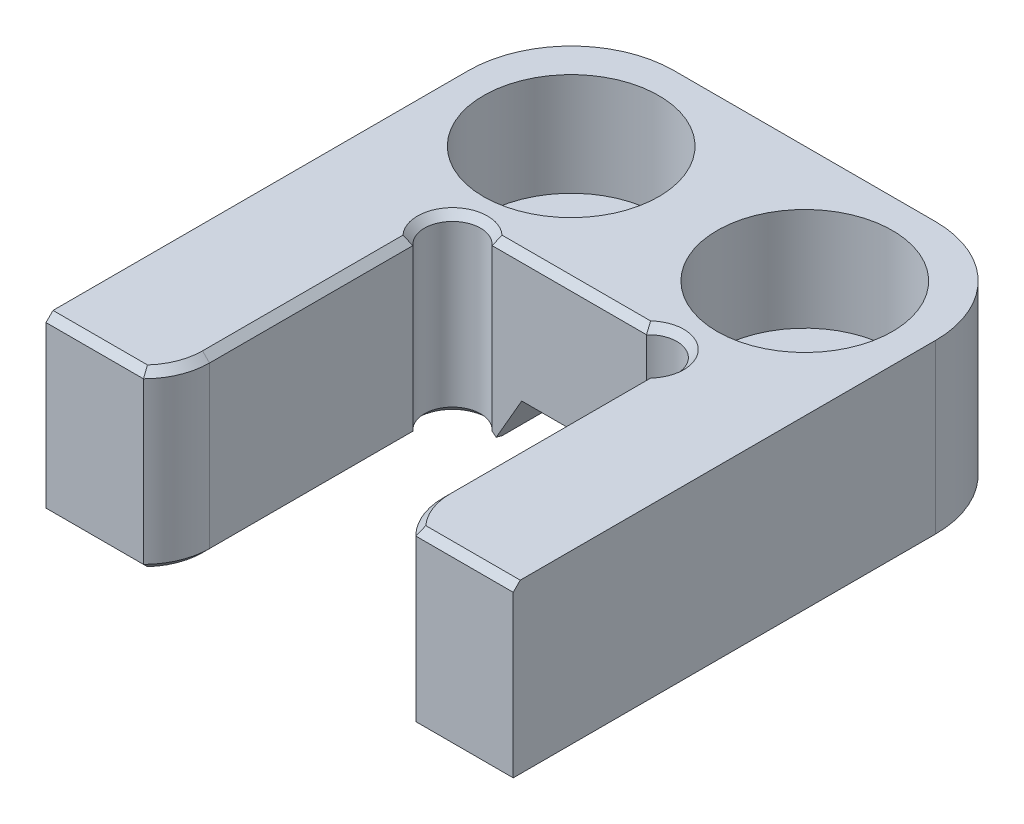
SolidWorks part; units mm, degrees
ref_plane "Front Plane" through (0, 0, 0) normal (0, 0, 1) x (1, 0, 0)
ref_plane "Top Plane" through (0, 0, 0) normal (0, 1, 0) x (1, 0, 0)
ref_plane "Right Plane" through (0, 0, 0) normal (1, 0, 0) x (0, 0, -1)
sketch "Sketch1" plane through (0, 0, 0) normal (0, 1, 0) x (1, 0, 0)
  line L0 (0, 0) -> (0, 50000) construction
  line L1 (0, 0) -> (50000, 0) construction
  line L2 (6.35, 0) -> (12.7, 0)
  line L3 (-12.7, 0) -> (-6.35, 0)
  line L4 (-12.7, 0) -> (-12.7, 28.5496)
  line L5 (-12.7, 28.5496) -> (12.7, 28.5496)
  line L6 (12.7, 0) -> (12.7, 28.5496)
  line L8 (-6.35, 0) -> (-6.35, 15.748)
  line L9 (-6.35, 15.748) -> (6.35, 15.748)
  line L10 (6.35, 0) -> (6.35, 15.748)
  dimension "D1" = 28.5496
  dimension "D2" = 25.4
  dimension "D3" = 12.7
  dimension "D4" = 15.748
extrude "Boss-Extrude1" add sketch "Sketch1" against normal blind 9.4996 separate body
fillet "Fillet1" radius 5.588 2 edges at (12.7, -4.7498, -28.5496) (-12.7, -4.7498, -28.5496)
sketch "Sketch2" plane through (0, 0, 0) normal (0, 1, 0) x (1, 0, 0)
  line L0 (0, 0) -> (0, 50000) construction
  line L1 (-6.35, 0) -> (-6.35, 15.748) construction
  line L2 (-12.7, 0) -> (-6.35, 0) construction
  line L3 (-6.35, 2.54) -> (-6.35, 12.7)
  line L4 (-12.7, 0) -> (-7.4024, 0)
  line L5 (12.7, 0) -> (12.7, -12.7)
  line L6 (-12.7, -12.7) -> (12.7, -12.7)
  line L7 (-6.35, 12.7) -> (6.35, 12.7)
  line L8 (-12.7, 0) -> (-12.7, -12.7)
  line L9 (12.7, 0) -> (7.4024, 0)
  line L10 (6.35, 2.54) -> (6.35, 12.7)
  arc A0 (-6.68, 0.5195) -> (-7.4024, 0) centre (-7.4024, 0.762) cw construction
  arc A1 (6.68, 0.5195) -> (6.35, 2.54) centre (12.7, 2.54) cw construction
  arc A2 (-6.68, 0.5195) -> (-6.35, 2.54) centre (-12.7, 2.54) ccw construction
  arc A3 (6.68, 0.5195) -> (7.4024, 0) centre (7.4024, 0.762) ccw construction
  arc A4 (7.4024, 0) -> (6.35, 2.54) centre (9.9414, 2.54) cw
  arc A5 (-7.4024, 0) -> (-6.35, 2.54) centre (-9.9414, 2.54) ccw
  point P14 (0, -12.7)
  point P24 (0, 12.7)
  dimension "D1" = 0.762
  dimension "D2" = 6.35
  dimension "D3" = 2.54
  dimension "D4" = 12.7
  dimension "D5" = 12.7
extrude "Cut-Extrude1" cut sketch "Sketch2" against normal through all
sketch "Sketch3" plane through (0, 0, 0) normal (0, 1, 0) x (1, 0, 0)
  line L2 (-6.858, 2.54) -> (-6.858, 15.748)
  line L3 (-6.858, 2.54) -> (-6.858, 15.748) construction
  line L4 (0, 0) -> (0, 50000) construction
  line L5 (-6.35, 16.256) -> (6.35, 16.256)
  line L6 (-6.35, 16.256) -> (6.35, 16.256) construction
  circle A0 centre (-5.334, 14.732) radius 1.524
  circle A1 centre (5.334, 14.732) radius 1.524
  dimension "D3" = 1.524
  dimension "D1" = 0.508
  dimension "D2" = 0.508
extrude "Cut-Extrude2" cut sketch "Sketch3" against normal through all
sketch "Sketch5" plane through (0, 0, -28.5496) normal (0, 0, -1) x (-1, 0, 0)
  line L0 (-3.175, -7.9121) -> (3.175, -7.9121)
  line L1 (-7.112, 0) -> (7.112, 0) construction
  line L2 (0, 0) -> (0, 50000) construction
  line L3 (3.175, -7.9121) -> (4.0915, -9.4996)
  line L4 (-7.112, -9.4996) -> (7.112, -9.4996) construction
  line L5 (-4.0915, -9.4996) -> (4.0915, -9.4996)
  line L6 (-3.175, -7.9121) -> (-4.0915, -9.4996)
  point P4 (0, 0)
  point P12 (0, -9.4996)
  point P13 (0, -7.9121)
  dimension "D1" = 30
  dimension "D2" = 1.5875
  dimension "D3" = 6.35
extrude "Cut-Extrude3" cut sketch "Sketch5" against normal through all
chamfer "Chamfer1" distance 0.381 angle 45 26 edges at (-3.6333, -8.7059, -28.5496) (0, -7.9121, -28.5496) (3.6333, -8.7059, -28.5496) (5.6018, -9.4996, -28.5496) (11.0633, -9.4996, -26.9129) (12.7, -9.4996, -11.4808) (10.0512, -9.4996, 0) (6.6235, -9.4996, -1.1653) (6.35, -9.4996, -8.068) (6.4116, -9.4996, -15.8096) (-5.6018, -9.4996, -28.5496) (-11.0633, -9.4996, -26.9129) (-12.7, -9.4996, -11.4808) (-6.4116, -9.4996, -15.8096) (-6.35, -9.4996, -8.068) (-6.6235, -9.4996, -1.1653) (-10.0512, -9.4996, 0) (10.0512, 0, 0) (6.6235, 0, -1.1653) (6.35, 0, -8.068) (6.4116, 0, -15.8096) (0, 0, -15.748) (-6.4116, 0, -15.8096) (-6.35, 0, -8.068) (-6.6235, 0, -1.1653) (-10.0512, 0, 0)
chamfer "Chamfer5" distance 3.81 angle 15 1 edges at (0, -7.9121, -15.748)
hole_wizard "#10 CBORE" positions "Sketch7" profile "Sketch6" counterbore size "#10" standard "Ansi Inch"
sketch "Sketch7" plane through (9.0831, 0, -5.226) normal (0, 1, 0) x (-1, 0, 0)
  line L0 (9.0831, 0) -> (9.0831, 50000) construction
  line L1 (1.9711, -23.3236) -> (16.1951, -23.3236) construction
  line L2 (21.7831, -17.7356) -> (21.7831, 4.845) construction
  point P0 (15.4331, -16.9736)
  point P11 (2.7331, -16.9736)
  dimension "D1" = 6.35
  dimension "D2" = 6.35
sketch "Sketch6" plane through (-6.35, 0, -22.1996) normal (1, 0, 0) x (0, 0, 1)
  line L0 (0, 0) -> (0, 9.4996)
  line L1 (0, 9.4996) -> (2.5527, 9.4996)
  line L3 (2.5527, 9.4996) -> (2.5527, 5.588)
  line L4 (2.5527, 5.588) -> (4.7625, 5.588)
  line L5 (4.7625, 5.588) -> (4.7625, 0)
  line L7 (4.7625, 0) -> (0, 0)
  line L11 (0, -6.35) -> (0, 107.95) construction
  dimension "Thru Hole Dia." = 5.1054
  dimension "Thru Hole Depth" = 9.4996
  dimension "C'Bore Dia." = 9.525
  dimension "C'Bore Depth" = 5.588
